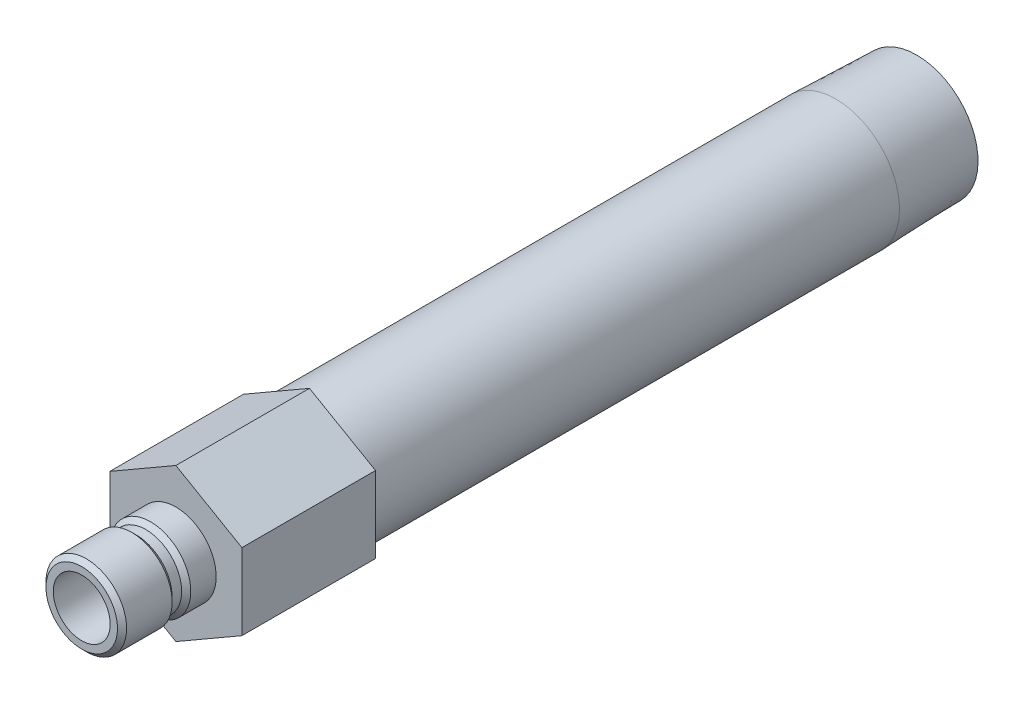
SolidWorks part; units mm, degrees
ref_plane "Front Plane" through (0, 0, 0) normal (0, 0, 1) x (1, 0, 0)
ref_plane "Top Plane" through (0, 0, 0) normal (0, 1, 0) x (1, 0, 0)
ref_plane "Right Plane" through (0, 0, 0) normal (1, 0, 0) x (0, 0, -1)
sketch "Sketch1" plane through (0, 0, 0) normal (1, 0, 0) x (0, 0, -1)
  line L0 (0, 0) -> (-18.923, 0) construction
  line L1 (-15.748, 4.7625) -> (-15.748, 5.9817)
  line L2 (-6.604, 5.9817) -> (-6.604, 0) construction
  line L3 (-14.986, 6.7437) -> (-7.366, 6.7437)
  line L4 (0, 10.668) -> (0, 0) construction
  line L5 (-6.604, 5.9817) -> (-5.0165, 5.9817)
  line L6 (-4.2545, 6.7437) -> (0, 6.7437)
  line L7 (0, 6.7437) -> (0, 10.668)
  line L8 (-6.604, 5.9817) -> (-7.366, 6.7437)
  line L9 (-5.0165, 5.9817) -> (-4.2545, 6.7437)
  line L10 (-15.748, 5.9817) -> (-14.986, 6.7437)
  line L11 (-15.748, 4.7625) -> (22.352, 4.7625)
  line L12 (0, 10.668) -> (110.3884, 10.668)
  line L13 (110.3884, 10.668) -> (123.952, 10.2441)
  line L14 (123.952, 10.2441) -> (123.952, 7.8994)
  line L15 (0, 6.7437) -> (22.352, 6.7437) construction
  line L16 (22.352, 6.7437) -> (22.352, 0) construction
  line L17 (22.352, 0) -> (0, 0) construction
  line L18 (22.352, 4.7625) -> (22.352, 7.8994)
  line L19 (22.352, 7.8994) -> (123.952, 7.8994)
  dimension "D1" = 15.748
  dimension "D2" = 1.5875
  dimension "D3" = 0.762
  dimension "D4" = 45
  dimension "D5" = 9.144
  dimension "D6" = 45
  dimension "D7" = 1.79
  dimension "D8" = 13.5636
  dimension "D9" = 139.7
  dimension "D10" = 3.175
  dimension "D11" = 9.525
  dimension "D12" = 21.336
  dimension "D13" = 38.1
  dimension "D14" = 13.4874
  dimension "D15" = 15.7988
revolve "Revolve1" add sketch "Sketch1" angle 360 about L0
sketch "Sketch2" plane through (0, 0, 0) normal (0, 0, 1) x (1, 0, 0)
  line L1 (-11.049, 6.3791) -> (-11.049, -6.3791)
  line L2 (-11.049, -6.3791) -> (0, -12.7583)
  line L3 (0, -12.7583) -> (11.049, -6.3791)
  line L4 (11.049, -6.3791) -> (11.049, 6.3791)
  line L5 (11.049, 6.3791) -> (0, 12.7583)
  line L6 (0, 12.7583) -> (-11.049, 6.3791)
  circle A0 centre (0, 0) radius 11.049 construction
  circle A1 centre (0, 0) radius 4.7625 construction
  circle A2 centre (0, 0) radius 4.7625
  dimension "D1" = 22.098
extrude "Boss-Extrude1" add sketch "Sketch2" against normal up to vertex (22.352 mm away) from vertex at 0
